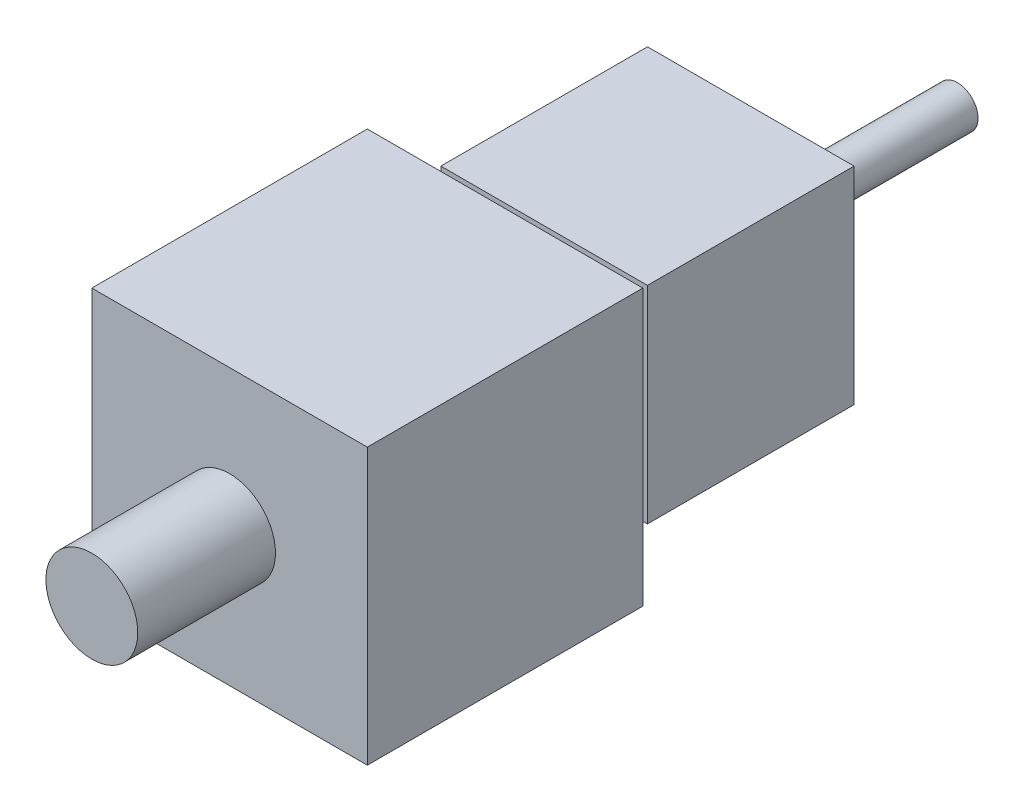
SolidWorks part; units mm, degrees
ref_plane "Ebene vorne" through (0, 0, 0) normal (0, 0, 1) x (1, 0, 0)
ref_plane "Ebene oben" through (0, 0, 0) normal (0, 1, 0) x (1, 0, 0)
ref_plane "Ebene rechts" through (0, 0, 0) normal (1, 0, 0) x (0, 0, -1)
ref_plane "Ebene1" through (0, 0, -5.3374) normal (0, 0, 1) x (1, 0, 0)
sketch "Vorderansicht" plane through (0, 0, -5.3374) normal (0, 0, 1) x (1, 0, 0)
  line L0 (0, 15) -> (15, 0) construction
  line L1 (0, 0) -> (15, 0)
  line L2 (0, 0) -> (0, 15)
  line L3 (0, 15) -> (15, 15)
  line L4 (15, 0) -> (15, 15)
  line L5 (15, 15) -> (0, 0) construction
  circle A0 centre (7.5, 7.5) radius 1.5
  dimension "D3" = 3
  dimension "D1" = 15
  dimension "D2" = 15
sketch "Seitenansicht" plane through (0, 0, 0) normal (1, 0, 0) x (0, 0, -1)
  line L1 (5.3374, 0) -> (20.3374, 0)
  line L2 (5.3374, 0) -> (5.3374, 15)
  line L3 (5.3374, 15) -> (20.3374, 15)
  line L4 (20.3374, 0) -> (20.3374, 15)
  line L7 (20.3374, 7.5) -> (35.3374, 7.5) construction
  dimension "D1" = 15
  dimension "D2" = 15
sketch "Skizze1" plane through (0, 0, 0) normal (0, 0, 1) x (1, 0, 0)
  line L1 (0, 0) -> (20, 0)
  line L2 (0, 0) -> (0, 20)
  line L3 (0, 20) -> (20, 20)
  line L4 (20, 0) -> (20, 20)
  dimension "T" = 20
extrude "Aufsatz-Linear austragen1" add sketch "Skizze1" along normal blind 20
sketch "Skizze2" plane through (0, 0, 20) normal (0, 0, 1) x (1, 0, 0)
  line L1 (0, 0) -> (20, 0) construction
  circle A0 centre (10, 10) radius 3.3333
  dimension "D3" = 6.6667
  dimension "D1" = 10
  dimension "D2" = 10
extrude "Aufsatz-Linear austragen2" add sketch "Skizze2" along normal blind 10 separate body
sketch "Skizze5" plane through (0, 0, -5.3374) normal (0, 0, 1) x (1, 0, 0)
  line L0 (15, 0) -> (15, 15) construction
  line L1 (0, 15) -> (15, 15) construction
  line L2 (0, 0) -> (0, 15) construction
  line L3 (0, 0) -> (15, 0) construction
  line L4 (15, 0) -> (15, 15)
  line L5 (0, 15) -> (15, 15)
  line L6 (0, 0) -> (0, 15)
  line L7 (0, 0) -> (15, 0)
extrude "Aufsatz-Linear austragen3" add sketch "Skizze5" against normal up to vertex (15 mm away) separate body
sketch "Skizze6" plane through (0, 0, -20.3374) normal (0, 0, -1) x (-1, 0, 0)
  circle A0 centre (-7.5, 7.5) radius 1.5
  circle A1 centre (-7.5, 7.5) radius 1.5 construction
extrude "Aufsatz-Linear austragen4" add sketch "Skizze6" along normal up to vertex (15 mm away) separate body
equation "\"D2@Skizze2\" = \"T\"/2"
equation "\"D3@Skizze2\" = \"T\"/3"
equation "\"D1@Skizze2\" = \"T\"/2"
